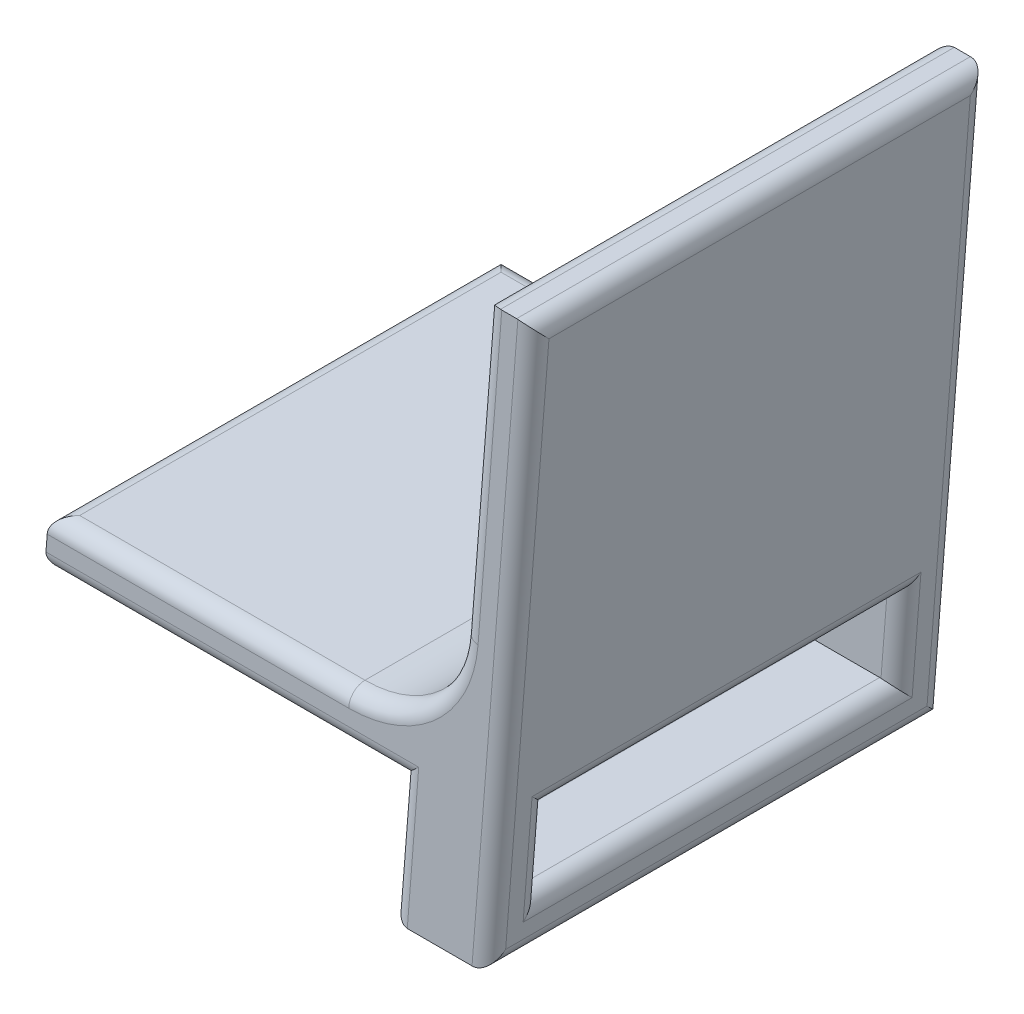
SolidWorks part; units mm, degrees
ref_plane "Front Plane" through (0, 0, 0) normal (0, 0, 1) x (1, 0, 0)
ref_plane "Top Plane" through (0, 0, 0) normal (0, 1, 0) x (1, 0, 0)
ref_plane "Right Plane" through (0, 0, 0) normal (1, 0, 0) x (0, 0, -1)
sketch "Sketch1" plane through (0, 0, 0) normal (0, 0, 1) x (1, 0, 0)
  line L0 (0, 0) -> (-25, 0)
  line L1 (-25, 0) -> (-25.2354, -2.9908)
  line L2 (-25.2354, -2.9908) -> (-3.2354, -2.9908)
  line L3 (3, 0) -> (4.9675, 25)
  line L4 (4.9675, 25) -> (1.9675, 25)
  line L5 (1.9675, 25) -> (0, 0)
  line L6 (3, 0) -> (2.1369, -10.9661)
  line L7 (2.1369, -10.9661) -> (-3.8631, -10.9661)
  line L8 (-3.8631, -10.9661) -> (-3.2354, -2.9908)
  dimension "D1" = 94.5
  dimension "D2" = 3
  dimension "D4" = 11
  dimension "D5" = 3
  dimension "D6" = 6
  dimension "D7" = 25
  dimension "D8" = 25
  dimension "D9" = 25
extrude "Boss-Extrude1" add sketch "Sketch1" along normal blind 28
sketch "Sketch2" plane through (2.9815, -0.2347, 0) normal (0.9969, -0.0785, 0) x (0, 0, -1)
  line L1 (-25, -7.7646) -> (-3, -7.7646)
  line L2 (-25, -7.7646) -> (-25, -2.7646)
  line L3 (-25, -2.7646) -> (-3, -2.7646)
  line L4 (-3, -7.7646) -> (-3, -2.7646)
  dimension "D1" = 3
  dimension "D2" = 5
  dimension "D3" = 3
  dimension "D4" = 3
extrude "Cut-Extrude1" cut sketch "Sketch2" along direction (1, 0, 0) on the side against the normal through all
fillet "Fillet1" radius 7 1 edges at (0, 0, 14)
fillet "Fillet2" radius 1 18 edges at (1.2376, 15.7254, 28) (-15.7354, 0, 28) (1.2376, 15.7254, 0) (-1.7191, 1.8597, 0) (-1.7191, 1.8597, 28) (-15.7354, 0, 0) (-14.2354, -2.9908, 0) (-3.5492, -6.9784, 0) (-3.5492, -6.9784, 28) (-14.2354, -2.9908, 28) (3.5522, 7.017, 0) (3.5522, 7.017, 28) (1.9675, 25, 14) (4.9675, 25, 14) (2.1369, -10.9661, 14) (-3.8631, -10.9661, 14) (-25.2354, -2.9908, 14) (-25, 0, 14)
fillet "Fillet3" radius 1 7 edges at (-3.4315, -5.483, 3) (-3.4315, -5.483, 25) (-3.6277, -7.9753, 14) (2.5685, -5.483, 3) (2.3723, -7.9753, 14) (2.5685, -5.483, 25) (2.7646, -2.9908, 14)
